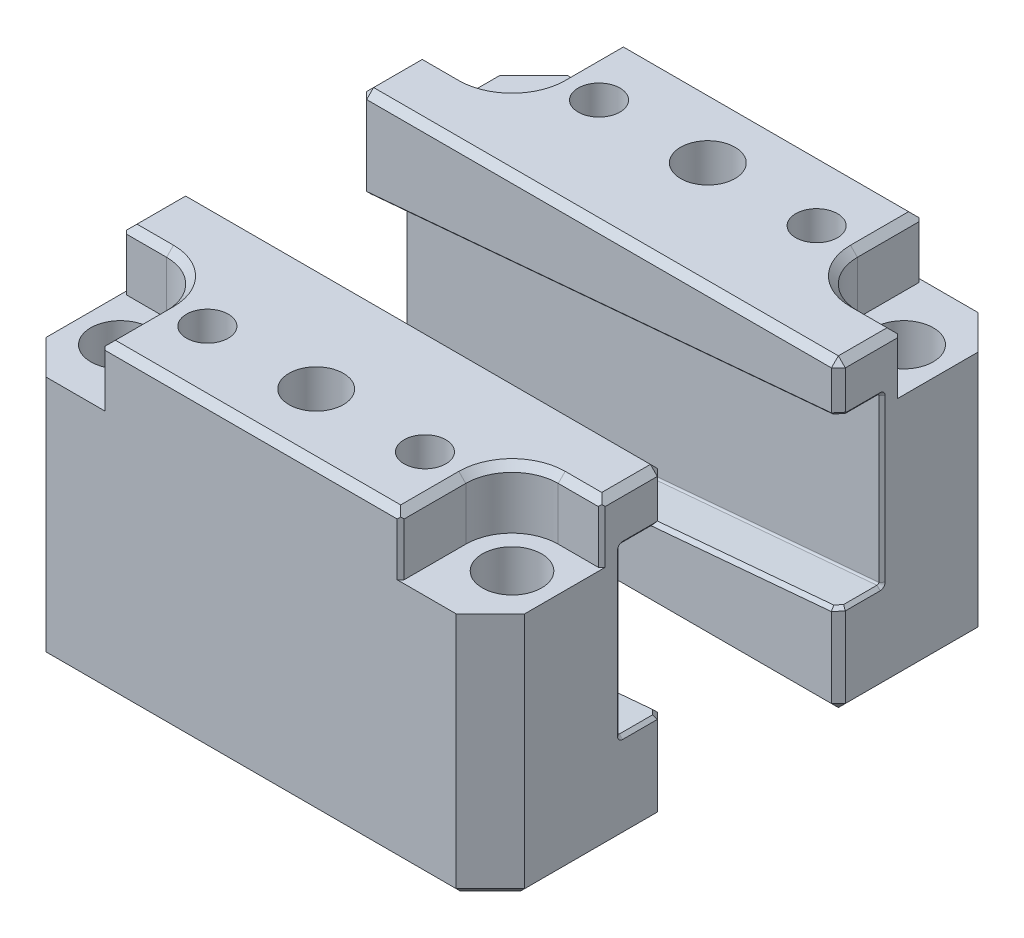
SolidWorks part; units mm, degrees
ref_plane "Front Plane" through (0, 0, 0) normal (0, 0, 1) x (1, 0, 0)
ref_plane "Top Plane" through (0, 0, 0) normal (0, 1, 0) x (1, 0, 0)
ref_plane "Right Plane" through (0, 0, 0) normal (1, 0, 0) x (0, 0, -1)
sketch "Sketch1" plane through (0, 0, 0) normal (1, 0, 0) x (0, 0, -1)
  line L0 (-12.7, 0) -> (-12.7, 44.45)
  line L1 (-12.7, 44.45) -> (-38.0746, 44.45)
  line L2 (-38.0746, 44.45) -> (-38.0746, 0)
  line L3 (-38.0746, 0) -> (-12.7, 0)
  line L4 (0, 48.255) -> (0, -16.2311) construction
  dimension "D1" = 25.4
  dimension "D2" = 44.45
  dimension "D3" = 76.1492
  dimension "D4" = 25.3746
extrude "Boss-Extrude1" add sketch "Sketch1" along normal mid plane 69.85
hole_wizard "CBORE for 5/16 Socket Head Cap Screw1" positions "Sketch4" profile "Sketch3" counterbore size "5/16" standard "ANSI Inch"
sketch "Sketch4" plane through (0, 44.45, 0) normal (0, 1, 0) x (1, 0, 0)
  line L0 (0, 7.4267) -> (0, -36.2312) construction
  line L2 (-19.6518, 0) -> (14.0148, 0) construction
  point P0 (-28.575, -28.575)
  point P11 (28.575, -28.575)
  dimension "D1" = 57.15
  dimension "D2" = 57.15
sketch "Sketch3" plane through (-28.575, 44.45, 28.575) normal (1, 0, 0) x (0, 0, 1)
  line L0 (0, 0) -> (0, 44.45)
  line L1 (0, 44.45) -> (4.2164, 44.45)
  line L3 (4.2164, 44.45) -> (4.2164, 8.6995)
  line L4 (4.2164, 8.6995) -> (6.7475, 8.6995)
  line L5 (6.7475, 8.6995) -> (6.7475, 0)
  line L7 (6.7475, 0) -> (0, 0)
  line L11 (0, -6.35) -> (0, 107.95) construction
  dimension "Thru Hole Dia." = 8.4328
  dimension "Thru Hole Depth" = 44.45
  dimension "C'Bore Dia." = 13.495
  dimension "C'Bore Depth" = 8.6995
hole_wizard "3/8-16 Tapped Hole3" positions "Sketch6" profile "Sketch5" tap size "3/8-16" standard "ANSI Inch"
sketch "Sketch6" plane through (0, 44.45, 0) normal (0, 1, 0) x (1, 0, 0)
  line L0 (0, 2.7703) -> (0, -32.9614) construction
  line L2 (-8.3627, 0) -> (4.6629, 0) construction
  line L4 (28.575, -28.575) -> (-28.575, -28.575) construction
  point P2 (0, -28.575)
sketch "Sketch5" plane through (0, 44.45, 28.575) normal (1, 0, 0) x (0, 0, 1)
  line L0 (0, 0) -> (0, 30.5787)
  line L1 (0, 30.5787) -> (3.9687, 28.194)
  line L2 (3.9687, 28.194) -> (3.9687, 0)
  line L5 (3.9687, 0) -> (0, 0)
  line L10 (0, 30.5787) -> (-3.9688, 28.194) construction
  line L11 (0, -6.35) -> (0, 107.95) construction
  dimension "Tap Drill Dia." = 7.9375
  dimension "Tap Drill Depth" = 28.194
  dimension "Drill Angle" = 118
chamfer "Chamfer1" distance 5 angle 45 2 edges at (34.925, 22.225, 38.0746) (-34.925, 22.225, 38.0746)
ref_plane "Plane3" through (0, 0, 28.575) normal (0, 0, 1) x (1, 0, 0)
sketch "Sketch17" plane through (0, 0, 28.575) normal (0, 0, 1) x (1, 0, 0)
  line L0 (-18.923, 44.45) -> (-18.923, 12.7763)
  line L1 (-18.923, 12.7763) -> (-19.05, 12.7)
  line L2 (-19.05, 12.7) -> (-19.05, 0)
  line L3 (-19.05, 0) -> (-15.875, 0)
  line L4 (-15.875, 0) -> (-15.875, 44.45)
  line L5 (-15.875, 44.45) -> (-18.923, 44.45)
  line L6 (-15.875, 46.7881) -> (-15.875, -4.206) construction
  line L7 (29.925, 0) -> (-29.925, 0) construction
  line L8 (29.925, 44.45) -> (-29.925, 44.45) construction
  line L9 (0, 0) -> (0, 52.4379) construction
  dimension "D1" = 12.7
  dimension "D2" = 59
  dimension "D3" = 6.35
  dimension "D4" = 6.096
  dimension "D5" = 31.75
revolve "Cut-Revolve2" cut sketch "Sketch17" angle 360 about L6
mirror "Mirror1" about plane through (0, 0, 0) normal (1, 0, 0) of "Cut-Revolve2"
sketch "Sketch8" plane through (0, 44.45, 0) normal (0, 1, 0) x (1, 0, 0)
  line L0 (-28.575, -21.8275) -> (-34.925, -21.8275)
  line L2 (-34.925, -12.7) -> (-34.925, -26.2932) construction
  line L3 (-34.925, -21.8275) -> (-34.925, -38.0746)
  line L4 (-34.925, -38.0746) -> (-21.8275, -38.0746)
  line L5 (29.925, -38.0746) -> (-29.925, -38.0746) construction
  line L6 (-21.8275, -38.0746) -> (-21.8275, -28.575)
  line L7 (0, -6.5077) -> (0, -47.736) construction
  line L8 (21.8275, -38.0746) -> (21.8275, -28.575)
  line L9 (34.925, -38.0746) -> (21.8275, -38.0746)
  line L10 (34.925, -21.8275) -> (34.925, -38.0746)
  line L11 (28.575, -21.8275) -> (34.925, -21.8275)
  arc A0 (-34.925, -30.8568) -> (-34.925, -26.2932) centre (-28.575, -28.575) ccw construction
  arc A1 (-34.925, -30.8568) -> (-34.925, -26.2932) centre (-28.575, -28.575) ccw construction
  arc A2 (-21.8275, -28.575) -> (-28.575, -21.8275) centre (-28.575, -28.575) ccw
  arc A3 (21.8275, -28.575) -> (28.575, -21.8275) centre (28.575, -28.575) cw
extrude "Cut-Extrude3" cut sketch "Sketch8" against normal up to surface (8.6995 mm away)
sketch "Sketch9" plane through (0, 0, 12.7) normal (0, 0, -1) x (-1, 0, 0)
  line L0 (0, 44.45) -> (0, 0) construction
  line L1 (-34.925, 44.45) -> (34.925, 44.45) construction
  line L2 (34.925, 0) -> (34.925, 44.45) construction
  line L3 (-34.925, 37.3279) -> (34.925, 31.2168)
  line L4 (-34.925, 37.3279) -> (-34.925, 13.2332)
  line L5 (-34.925, 13.2332) -> (34.925, 7.1221)
  line L6 (34.925, 31.2168) -> (34.925, 7.1221)
  line L7 (-34.925, 37.3279) -> (34.925, 7.1221) construction
  line L8 (-34.925, 13.2332) -> (34.925, 31.2168) construction
  line L9 (-10.1137, 22.225) -> (18.4449, 22.225) construction
  point P5 (0, 22.225)
  dimension "D1" = 24.003
  dimension "D2" = 5
extrude "Cut-Extrude4" cut sketch "Sketch9" against normal offset from surface (6.35 mm away) 19.05
hole_wizard "3/8-16 Tapped Hole2" positions "Sketch11" profile "Sketch10" tap size "3/8-16" standard "ANSI Inch"
sketch "Sketch11" plane through (0, 0, 0) normal (0, -1, 0) x (-1, 0, 0)
  point P0 (28.575, -28.575)
  point P3 (-28.575, -28.575)
sketch "Sketch10" plane through (-28.575, 0, 28.575) normal (1, 0, 0) x (0, 0, -1)
  line L0 (0, 0) -> (0, 44.45)
  line L1 (0, 44.45) -> (4.318, 44.45)
  line L2 (4.318, 44.45) -> (4.318, 0)
  line L5 (4.318, 0) -> (0, 0)
  line L11 (0, -6.35) -> (0, 107.95) construction
  dimension "Thru Tap Drill Dia." = 8.636
  dimension "Thru Tap Drill Depth" = 44.45
ref_plane "Plane1" through (-1.9297, 22.0562, 0) normal (-0.0872, 0.9962, 0) x (0.9962, 0.0872, 0)
fillet "Fillet1" radius 0.254 2 edges at (0, 34.2723, 19.05) (0, 10.1777, 19.05)
chamfer "Chamfer2" distance 1.016 angle 45 20 edges at (0, 0, 12.7) (34.925, 6.6166, 12.7) (34.925, 0, 22.8873) (32.425, 0, 35.5746) (0, 0, 38.0746) (-32.425, 0, 35.5746) (-34.925, 0, 22.8873) (-34.925, 3.5611, 12.7) (-23.8038, 44.45, 23.8038) (-34.925, 44.45, 17.2637) (-34.925, 37.8334, 12.7) (0, 44.45, 12.7) (23.8038, 44.45, 23.8038) (0, 44.45, 38.0746) (34.925, 44.45, 17.2637) (34.925, 40.8889, 12.7) (-21.8275, 44.45, 33.3248) (-31.75, 44.45, 21.8275) (21.8275, 44.45, 33.3248) (31.75, 44.45, 21.8275)
chamfer "Chamfer3" distance 0.508 angle 45 20 edges at (34.925, 37.3279, 16.256) (34.925, 37.2532, 18.9756) (34.925, 25.2805, 19.05) (34.925, 13.3079, 18.9756) (34.925, 13.2332, 16.256) (-34.417, 31.2612, 13.208) (34.417, 37.2834, 13.208) (0, 34.2723, 12.7) (-34.925, 31.2168, 16.256) (-34.925, 31.1421, 18.9756) (-34.925, 19.1695, 19.05) (-34.925, 7.1968, 18.9756) (-34.925, 7.1221, 16.256) (-34.417, 7.1666, 13.208) (0, 10.1777, 12.7) (34.417, 13.1888, 13.208) (-21.8275, 39.5923, 38.0746) (-34.925, 39.5923, 21.8275) (21.8275, 39.5922, 38.0746) (34.925, 39.5923, 21.8275)
ref_plane "Plane2" through (19.05, 0, 0) normal (1, 0, 0) x (0, 0, -1)
sketch "Sketch18" plane through (19.05, 0, 0) normal (1, 0, 0) x (0, 0, -1)
  line L0 (-19.05, 0) -> (-19.05, 6.6028) construction
  line L1 (-19.05, 4.93) -> (-17.55, 4.064)
  line L2 (-17.55, 4.064) -> (-17.55, 0)
  line L3 (-17.55, 0) -> (-19.05, 0)
  line L4 (-19.05, 0) -> (-19.05, 4.93)
  dimension "D1" = 60
  dimension "D2" = 4.064
  dimension "D3" = 3
revolve "Cut-Revolve3" cut sketch "Sketch18" angle 360 about L0
chamfer "Chamfer4" distance 0.508 angle 45 2 edges at (19.05, 0, 28.575) (-19.05, 0, 28.575)
mirror "Mirror2" about plane through (0, 0, 0) normal (0, 0, 1)
